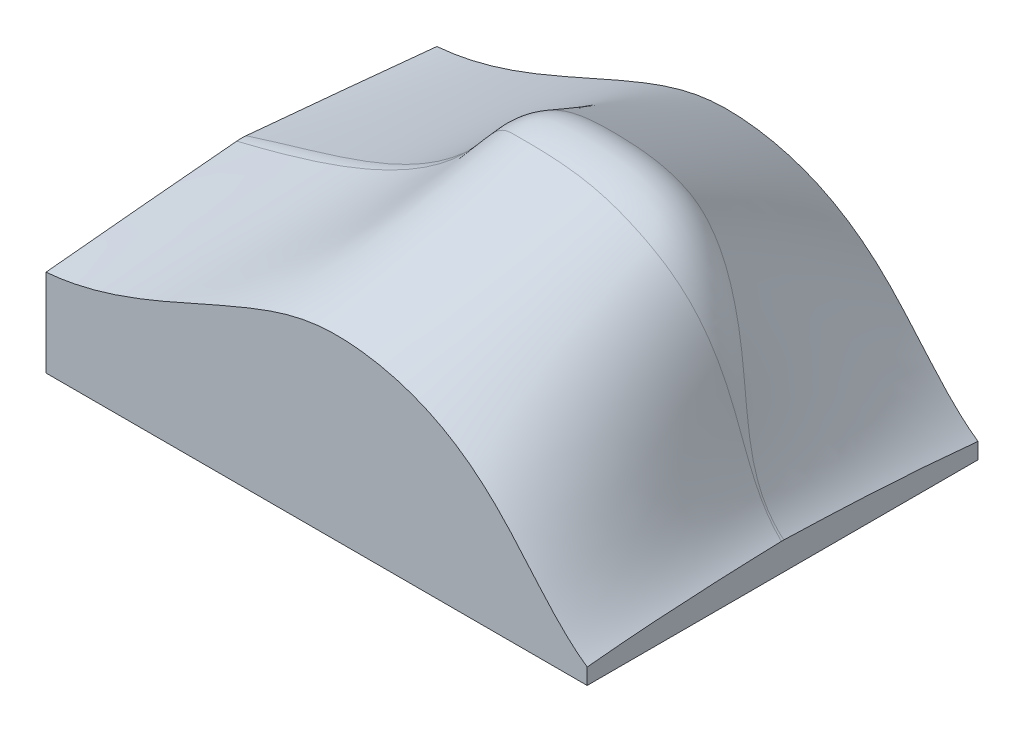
SolidWorks part; units mm, degrees
ref_plane "Y" through (0, 0, 0) normal (0, 0, 1) x (1, 0, 0)
ref_plane "Z" through (0, 0, 0) normal (0, 1, 0) x (1, 0, 0)
ref_plane "X" through (0, 0, 0) normal (1, 0, 0) x (0, 0, -1)
sketch "Skizze1" plane through (0, 0, 0) normal (0, 1, 0) x (1, 0, 0)
  line L0 (0, 0) -> (0, 19.9909) construction
  line L1 (-45, 32.5) -> (45, 32.5)
  line L2 (-45, 32.5) -> (-45, -32.5)
  line L3 (-45, -32.5) -> (45, -32.5)
  line L4 (45, 32.5) -> (45, -32.5)
  line L5 (0, 0) -> (20.4549, 0) construction
  dimension "D1" = 90
  dimension "D2" = 65
extrude "Platte" add sketch "Skizze1" along normal blind 50
sketch "Skizze2" plane through (0, 0, 0) normal (0, 0, 1) x (1, 0, 0)
  spline S0 degree 3 poles (-53.4499, 14.8108) (-38.0052, 20.6704) (-12.7057, 23.1566) (1.7831, 46.9012) (14.6958, 47.7418) (30.3176, 46.1433) (39.8851, 20.8859) (39.5907, 1.9955) (56.8514, 0) knots 0 0 0 0 0.358247 0.459122 0.515728 0.613675 0.756764 1 1 1 1
ref_plane "Ebene1" through (0, 0, 35.3929) normal (0, 0, 1) x (1, 0, 0)
sketch "Skizze3" plane through (0, 0, 35.3929) normal (0, 0, 1) x (1, 0, 0)
  spline S0 degree 3 poles (-53.4499, 14.8108) (-34.2739, 10.8113) (-9.3422, 35.2541) (32.0579, 20.8434) (44.612, -2.8172) (56.8514, 0) knots 0 0 0 0 0.457284 0.70082 1 1 1 1
surface "Oberfläche-Ausformung1"
mirror "Spiegeln1" about plane through (0, 0, 0) normal (0, 0, 1)
surface "Oberfläche-Zusammenfügen1"
other "Oberflächenschnitt1"
fillet "Verrundung2" radius 9 3 edges at (45, 4.2465, 10.0774) (-45, 16.6912, -10.0419)
